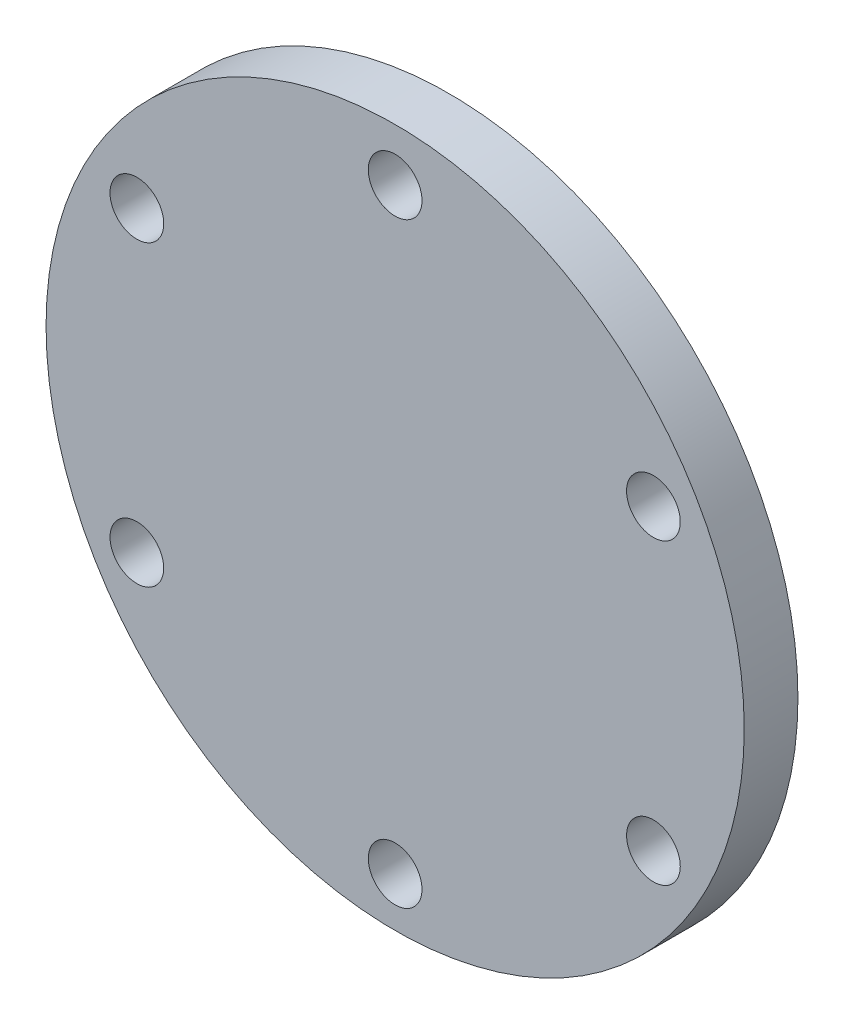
SolidWorks part; units mm, degrees
ref_plane "Front Plane" through (0, 0, 0) normal (0, 0, 1) x (1, 0, 0)
ref_plane "Top Plane" through (0, 0, 0) normal (0, 1, 0) x (1, 0, 0)
ref_plane "Right Plane" through (0, 0, 0) normal (1, 0, 0) x (0, 0, -1)
sketch "Sketch2" plane through (0, 0, 0) normal (0, 0, 1) x (1, 0, 0)
  circle A0 centre (0, 0) radius 41.275
  dimension "D1" = 82.55
extrude "Boss-Extrude1" add sketch "Sketch2" along normal blind 6.35
sketch "Sketch5" plane through (0, 0, 6.35) normal (0, 0, 1) x (1, 0, 0)
  circle A1 centre (0, 35.052) radius 3.175
  point P15 (0, 0)
  dimension "D1" = 6.35
  dimension "D2" = 35.052
extrude "Cut-Extrude3" cut sketch "Sketch5" against normal through all
pattern_circular "CirPattern2" count 6 over 360 about axis through (0, -0.2086, 0) along (0, 0, 1) of "Cut-Extrude3"
